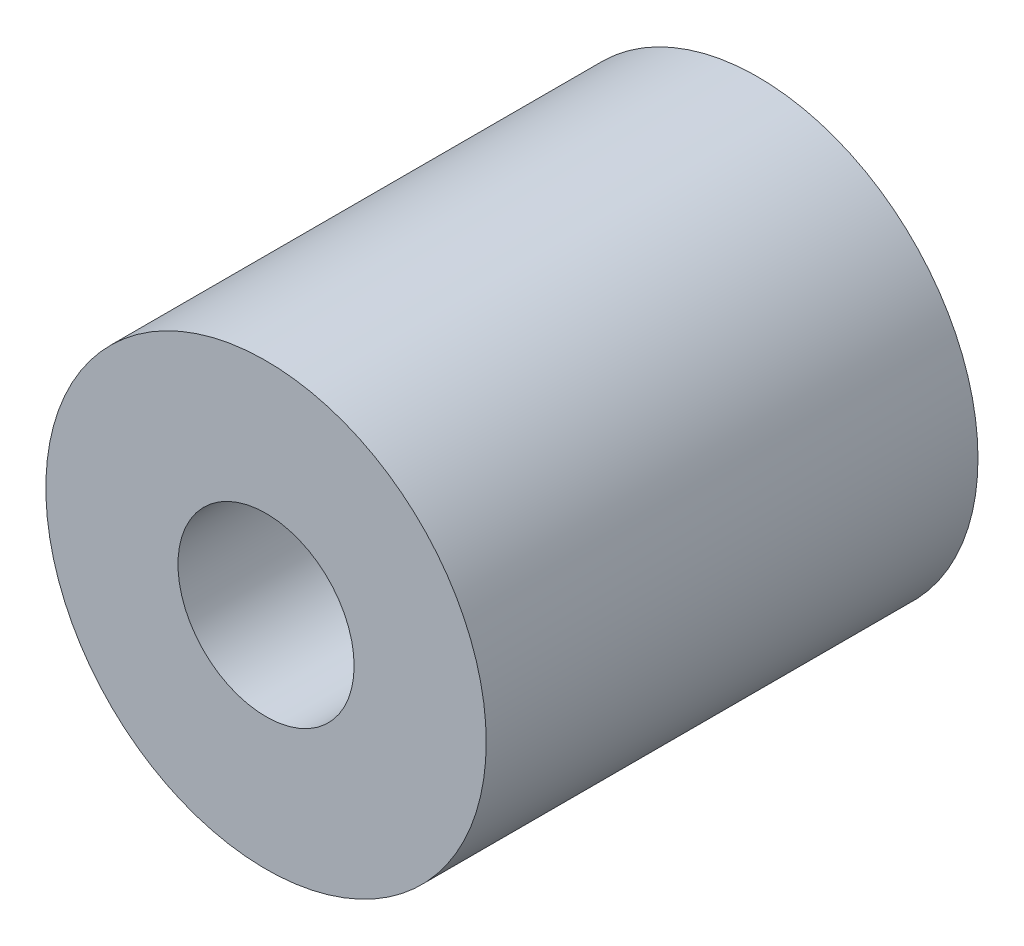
SolidWorks part; units mm, degrees
ref_plane "Front Plane" through (0, 0, 0) normal (0, 0, 1) x (1, 0, 0)
ref_plane "Top Plane" through (0, 0, 0) normal (0, 1, 0) x (1, 0, 0)
ref_plane "Right Plane" through (0, 0, 0) normal (1, 0, 0) x (0, 0, -1)
sketch "Sketch1" plane through (0, 0, 0) normal (0, 0, 1) x (1, 0, 0)
  circle A0 centre (0, 0) radius 6
  circle A1 centre (0, 0) radius 15
  dimension "D1" = 12
  dimension "D2" = 30
extrude "Boss-Extrude1" add sketch "Sketch1" along normal blind 33.5
